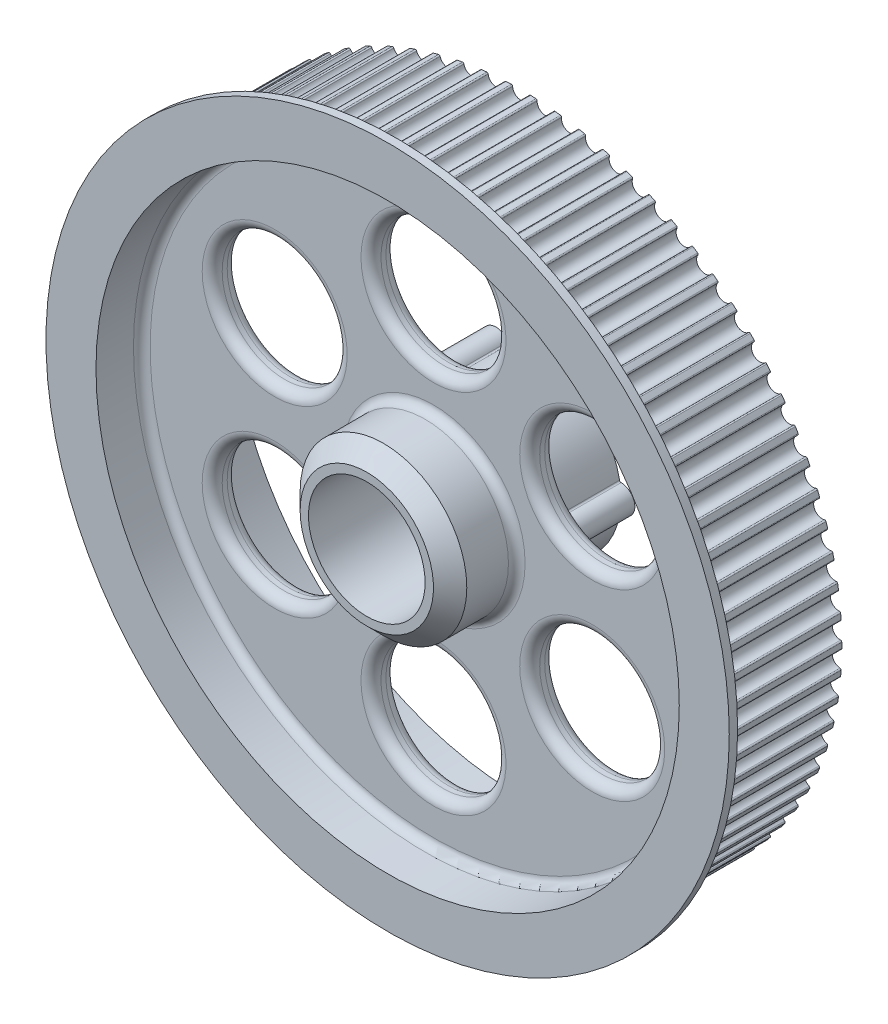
SolidWorks part; units mm, degrees
ref_plane "Plan1" through (0, 0, 0) normal (0, 0, 1) x (1, 0, 0)
ref_plane "Plan2" through (0, 0, 0) normal (0, 1, 0) x (1, 0, 0)
ref_plane "Plan3" through (0, 0, 0) normal (1, 0, 0) x (0, 0, -1)
sketch "Esquisse1" plane through (0, 0, 0) normal (1, 0, 0) x (0, 0, -1)
  line L0 (-29, 0) -> (45, 0) construction
  line L1 (0, 7) -> (0, 10)
  line L2 (0, 10) -> (-8.5, 10)
  line L3 (-18, 41) -> (-17, 41)
  line L4 (-2, 35) -> (-2, 38.5071)
  line L5 (-17, 38.5071) -> (-17, 41)
  line L6 (-18, 41) -> (-18, 35)
  line L7 (-17, 38.5071) -> (-2, 38.5071)
  line L8 (-9.5, 34) -> (-9.5, 11)
  line L9 (-12.5, 34) -> (-12.5, 11)
  line L10 (-18, 35) -> (-13.5, 35)
  line L11 (-8.5, 35) -> (-2, 35)
  line L12 (-20.5, 10) -> (-20.5, 7)
  line L13 (-13.5, 10) -> (-20.5, 10)
  line L17 (-20.5, 7) -> (0, 7)
  arc A0 (-12.5, 34) -> (-13.5, 35) centre (-13.5, 34) ccw
  arc A1 (-8.5, 35) -> (-9.5, 34) centre (-8.5, 34) ccw
  arc A2 (-8.5, 10) -> (-9.5, 11) centre (-8.5, 11) cw
  arc A3 (-13.5, 10) -> (-12.5, 11) centre (-13.5, 11) ccw
  point P23 (-9.5, 35)
  point P28 (-12.5, 10)
  dimension "D9" = 1
  dimension "D1" = 7
  dimension "D2" = 10
  dimension "D3" = 35
  dimension "D4" = 15
  dimension "D5" = 1
  dimension "D6" = 38.5071
  dimension "D7" = 3
  dimension "D8" = 41
  dimension "D10" = 20.5
  dimension "D11" = 9.5
  dimension "D12" = 2
revolve "Base-Révolution" add sketch "Esquisse1" angle 360 about L0
chamfer "Chanfrein1" distance 2 angle 45 1 edges at (10, 0, 20.5)
sketch "Esquisse4" plane through (0, 0, 9.5) normal (0, 0, -1) x (-1, 0, 0)
  line L0 (0, 0) -> (0, 44) construction
  circle A0 centre (0, 22) radius 7.5
  dimension "D1" = 22
  dimension "D2" = 15
extrude "trous" cut sketch "Esquisse4" against normal through all
fillet "Congé1" radius 1.2 2 edges at (-7.5, 22, 12.5) (-7.5, 22, 9.5)
pattern_circular "Répétition circulaire2" count 6 over 360 about axis through (0, 0, 0) along (0, 0, 1) of "trous", "Congé1"
sketch "Esquisse5" plane through (0, 0, 0) normal (0, 0, -1) x (-1, 0, 0)
  line L0 (0, 0) -> (15.5664, 26.9618) construction
  line L1 (0, 0) -> (30, 0) construction
  arc A1 (6.3711, 7.7078) -> (3.4896, 9.3714) centre (5, 8.6603) ccw
  circle A2 centre (0, 0) radius 10 construction
  arc A13 (6.3711, 7.7078) -> (3.4896, 9.3714) centre (0, 0) ccw
  dimension "D3" = 1.6695
  dimension "D1" = 60
extrude "nervures" add sketch "Esquisse5" along normal up to surface (9.5 mm away)
fillet "Congé2" radius 0.2 5 edges at (-5.8347, 10.106, 9.5) (-6.3711, 7.7078, 4.25) (-3.4896, 9.3714, 4.25) (-3.5942, 9.5606, 9.1181) (-6.5048, 7.9373, 9.1751)
pattern_circular "Répétition circulaire1" count 3 over 360 about axis through (0, 0, 29) along (0, 0, -1) of "nervures", "Congé2"
sketch "Esquisse8" plane through (0, 0, 2) normal (0, 0, -1) x (-1, 0, 0)
  line L0 (0, 0) -> (0, 44.0596) construction
  arc A0 (-0.9992, 38.346) -> (0.9992, 38.346) centre (0, 38.3871) ccw
  circle A1 centre (0, 0) radius 38.5071 construction
  arc A2 (1.1535, 38.4898) -> (-1.1535, 38.4898) centre (0, 0) ccw
  arc A3 (-0.9992, 38.346) -> (-1.1535, 38.4898) centre (-1.149, 38.3399) ccw
  arc A4 (1.1535, 38.4898) -> (0.9992, 38.346) centre (1.149, 38.3399) ccw
  dimension "D1" = 2
  dimension "D3" = 0.3
  dimension "D4" = 0.3
  dimension "D2" = 38.3871
extrude "Denture" cut sketch "Esquisse8" against normal up to surface (15 mm away)
pattern_circular "Répétition circulaire denture" count 82 every 4.39 about axis through (0, 0, 0) along (0, 0, 1) of "Denture"
ref_plane "Plan médian poulie" through (0, 0, 9.5) normal (0, 0, -1) x (-1, 0, 0)
sketch "Diamètre primitif" plane through (0, 0, 9.5) normal (0, 0, -1) x (-1, 0, 0)
  circle A0 centre (0, 0) radius 39.1521 construction
  dimension "D1" = 78.3042
